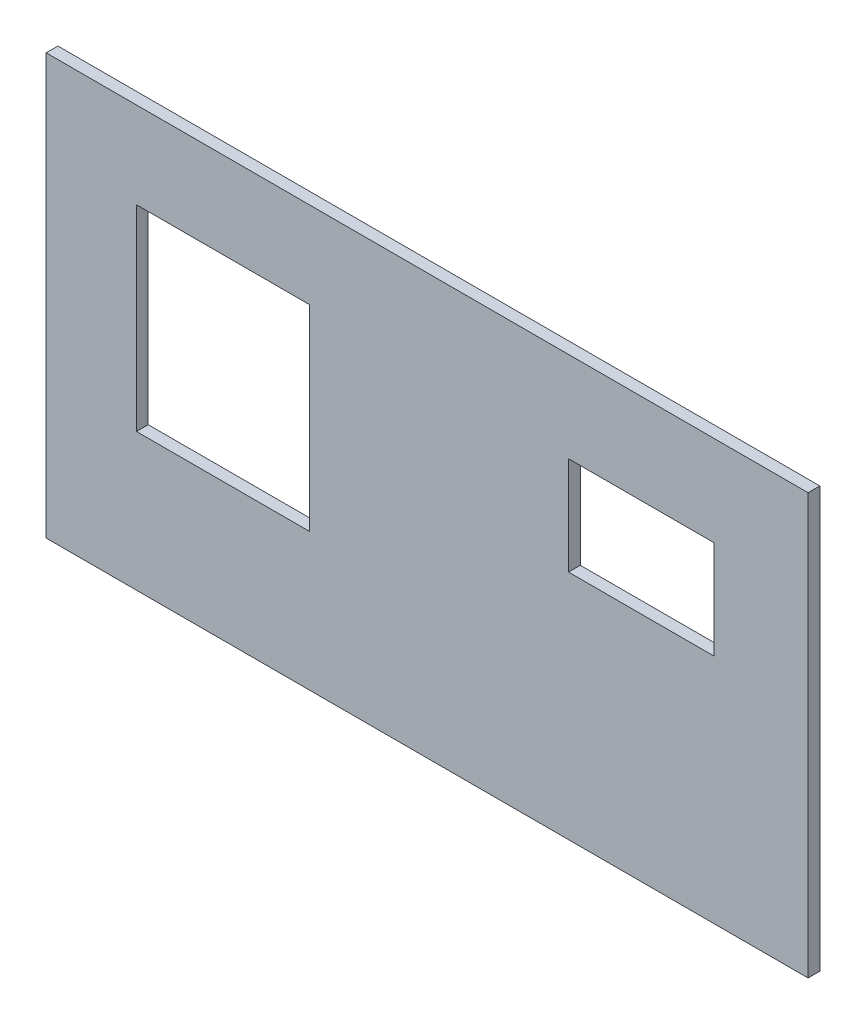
SolidWorks part; units mm, degrees
ref_plane "Plan de face" through (0, 0, 0) normal (0, 0, 1) x (1, 0, 0)
ref_plane "Plan de dessus" through (0, 0, 0) normal (0, 1, 0) x (1, 0, 0)
ref_plane "Plan de droite" through (0, 0, 0) normal (1, 0, 0) x (0, 0, -1)
sketch "Esquisse1" plane through (0, 0, 0) normal (0, 0, 1) x (1, 0, 0)
  line L1 (0, 0) -> (194, 0)
  line L2 (0, 0) -> (0, 107)
  line L3 (0, 107) -> (194, 107)
  line L4 (194, 0) -> (194, 107)
  dimension "D1" = 194
  dimension "D2" = 107
extrude "Extrusion1" add sketch "Esquisse1" along normal blind 3
sketch "Esquisse2" plane through (0, 0, 3) normal (0, 0, 1) x (1, 0, 0)
  line L0 (0, 0) -> (194, 0) construction
  line L1 (23, 35) -> (67, 35)
  line L2 (23, 35) -> (23, 85)
  line L3 (23, 85) -> (67, 85)
  line L4 (67, 35) -> (67, 85)
  line L5 (133, 59) -> (170, 59)
  line L6 (133, 59) -> (133, 84)
  line L7 (133, 84) -> (170, 84)
  line L8 (170, 59) -> (170, 84)
  line L9 (0, 107) -> (0, 0) construction
  line L10 (194, 0) -> (194, 107) construction
  dimension "D1" = 44
  dimension "D2" = 50
  dimension "D3" = 35
  dimension "D4" = 23
  dimension "D5" = 37
  dimension "D6" = 25
  dimension "D7" = 59
  dimension "D8" = 24
extrude "Enlèv. mat.-Extru.1" cut sketch "Esquisse2" against normal blind 3
